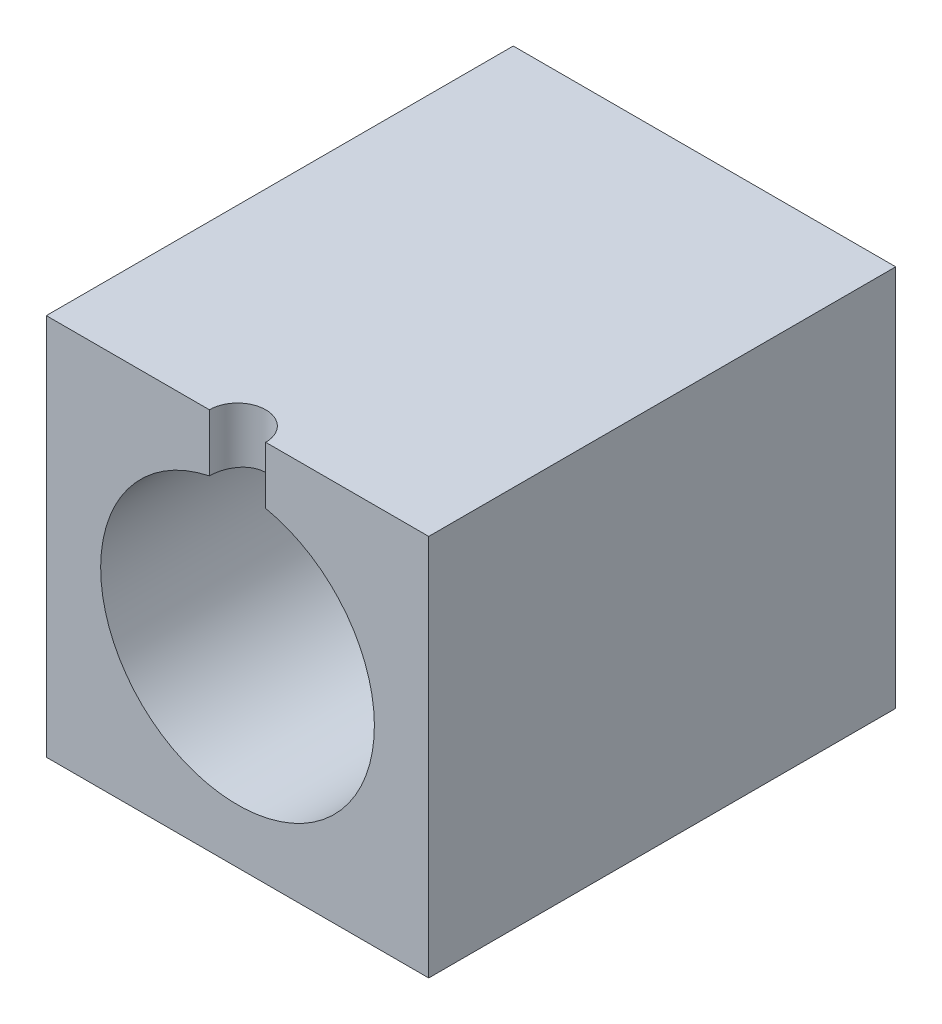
SolidWorks part; units mm, degrees
ref_plane "Front Plane" through (0, 0, 0) normal (0, 0, 1) x (1, 0, 0)
ref_plane "Top Plane" through (0, 0, 0) normal (0, 1, 0) x (1, 0, 0)
ref_plane "Right Plane" through (0, 0, 0) normal (1, 0, 0) x (0, 0, -1)
sketch "Sketch1" plane through (0, 0, 0) normal (0, 0, 1) x (1, 0, 0)
  line L0 (-14.1949, 15.964) -> (-14.1949, 10.964) construction
  line L5 (-32.9449, 10.964) -> (4.5551, -26.536) construction
  line L6 (-32.9449, -26.536) -> (4.5551, 10.964) construction
  line L7 (-37.9449, 15.964) -> (9.5551, 15.964)
  line L8 (-37.9449, 15.964) -> (-37.9449, -31.536)
  line L9 (-37.9449, -31.536) -> (9.5551, -31.536)
  line L10 (9.5551, 15.964) -> (9.5551, -31.536)
  line L11 (-37.9449, 15.964) -> (9.5551, -31.536) construction
  line L12 (-37.9449, -31.536) -> (9.5551, 15.964) construction
  line L13 (4.5551, -7.786) -> (9.5551, -7.786) construction
  line L14 (-14.1949, -26.536) -> (-14.1949, -31.536) construction
  line L15 (-32.9449, -7.786) -> (-37.9449, -7.786) construction
  circle A0 centre (-14.1949, -7.786) radius 18.6729
  point P5 (-14.1949, -7.786)
extrude "Boss-Extrude1" add sketch "Sketch1" along normal blind 19
sketch "Sketch2" plane through (0, 0, 19) normal (0, 0, 1) x (1, 0, 0)
  line L0 (-14.1949, 10.964) -> (-14.1949, -26.536) construction
  line L1 (4.5551, 10.964) -> (-32.9449, 10.964) construction
  line L2 (-32.9449, -26.536) -> (4.5551, -26.536) construction
  line L3 (4.5551, -7.786) -> (-32.9449, -7.786) construction
  line L4 (4.5551, -26.536) -> (4.5551, 10.964) construction
  line L5 (-32.9449, 10.964) -> (-32.9449, -26.536) construction
  line L11 (-31.1949, 9.214) -> (2.8051, -24.786) construction
  line L12 (-31.1949, -24.786) -> (2.8051, 9.214) construction
  line L13 (-37.9449, 15.964) -> (9.5551, 15.964)
  line L14 (-37.9449, 15.964) -> (-37.9449, -31.536)
  line L15 (-37.9449, -31.536) -> (9.5551, -31.536)
  line L16 (9.5551, 15.964) -> (9.5551, -31.536)
  line L17 (-37.9449, 15.964) -> (9.5551, -31.536) construction
  line L18 (-37.9449, -31.536) -> (9.5551, 15.964) construction
  circle A0 centre (-14.1949, -7.786) radius 17
  point P12 (-14.1949, -7.786)
  point P17 (-14.1949, -7.786)
  dimension "D3" = 34
  dimension "D1" = 34
  dimension "D2" = 34
extrude "Boss-Extrude2" add sketch "Sketch2" along normal blind 39
sketch "Sketch3" plane through (0, 15.964, 0) normal (0, 1, 0) x (1, 0, 0)
  line L0 (-14.1949, -58) -> (-14.1949, 0) construction
  line L1 (9.5551, -58) -> (-37.9449, -58) construction
  line L2 (9.5551, 0) -> (-37.9449, 0) construction
  circle A0 centre (-14.1949, -58) radius 3.5
  dimension "D1" = 7
extrude "Cut-Extrude1" cut sketch "Sketch3" against normal blind 14 and the other way blind 5
equation "\"thickness of material\"= 5mm"
equation "\"D4@Sketch1\"=\"thickness of material\""
equation "\"D3@Sketch1\"=\"thickness of material\""
